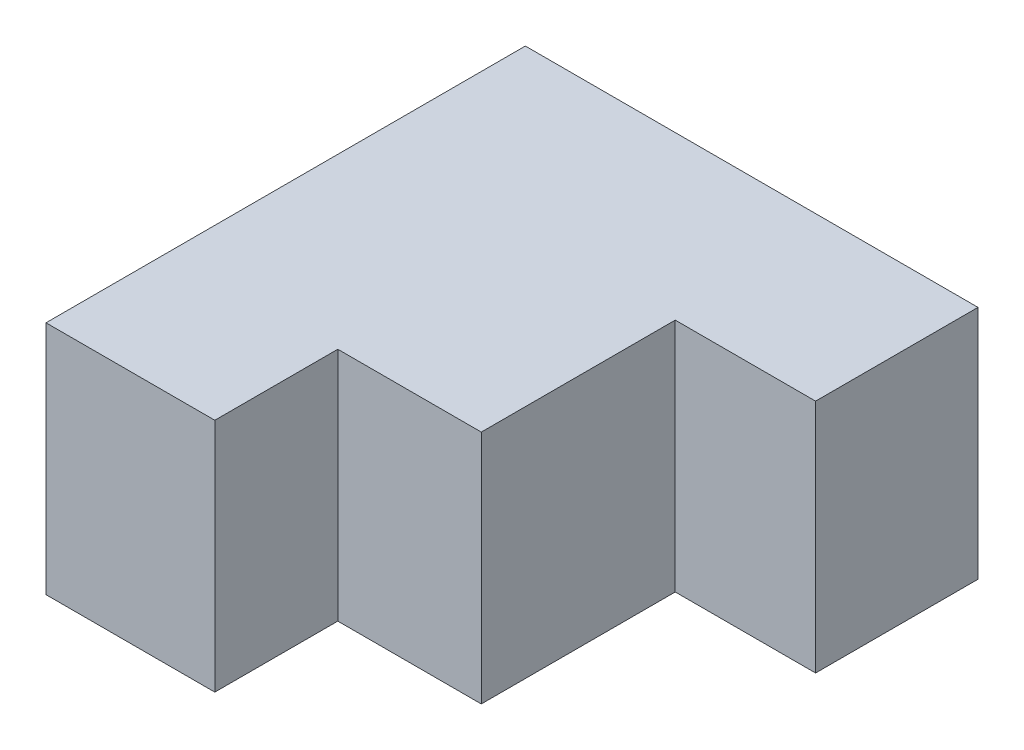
SolidWorks part; units mm, degrees
ref_plane "Front Plane" through (0, 0, 0) normal (0, 0, 1) x (1, 0, 0)
ref_plane "Top Plane" through (0, 0, 0) normal (0, 1, 0) x (1, 0, 0)
ref_plane "Right Plane" through (0, 0, 0) normal (1, 0, 0) x (0, 0, -1)
sketch "Sketch1" plane through (0, 0, 0) normal (0, 1, 0) x (1, 0, 0)
  line L0 (0, 0) -> (0, 81.4313)
  line L1 (0, 81.4313) -> (76.8932, 81.4313)
  line L2 (76.8932, 81.4313) -> (76.8932, 53.8411)
  line L3 (76.8932, 53.8411) -> (53.0532, 53.8411)
  line L4 (53.0532, 53.8411) -> (53.0532, 20.8935)
  line L5 (53.0532, 20.8935) -> (28.6773, 20.8935)
  line L6 (28.6773, 20.8935) -> (28.6773, 0)
  line L7 (28.6773, 0) -> (0, 0)
extrude "Boss-Extrude1" add sketch "Sketch1" along normal blind 40
